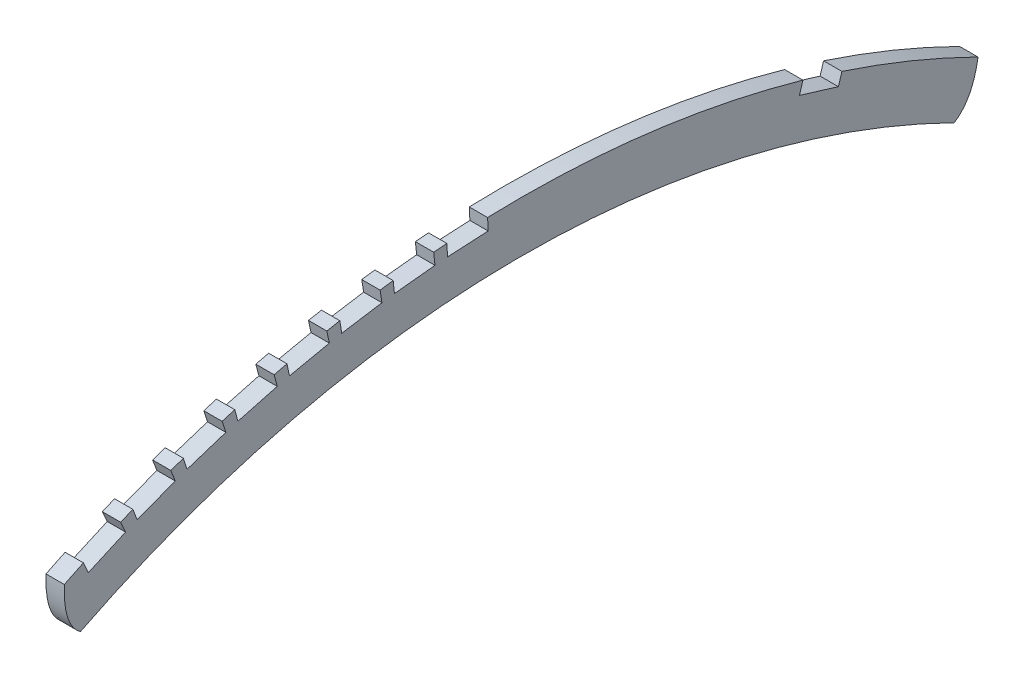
SolidWorks part; units mm, degrees
ref_plane "Front Plane" through (0, 0, 0) normal (0, 0, 1) x (1, 0, 0)
ref_plane "Top Plane" through (0, 0, 0) normal (0, 1, 0) x (1, 0, 0)
ref_plane "Right Plane" through (0, 0, 0) normal (1, 0, 0) x (0, 0, -1)
sketch "Sketch1" plane through (0, 0, 0) normal (1, 0, 0) x (0, 0, -1)
  line L2 (314.9485, 961.744) -> (311.4978, 950.4573)
  line L3 (311.4978, 950.4573) -> (292.3717, 956.3048)
  line L4 (292.3717, 956.3048) -> (273.2456, 962.1522)
  line L5 (273.2456, 962.1522) -> (276.6963, 973.4388)
  line L673 (-406.7366, 913.5455) -> (-425.0076, 905.4107)
  line L674 (-425.0076, 905.4107) -> (-429.808, 916.1927)
  line L677 (-393.2662, 932.4622) -> (-388.4657, 921.6802)
  line L678 (-388.4657, 921.6802) -> (-406.7366, 913.5455)
  line L679 (-358.3679, 933.5804) -> (-377.0396, 926.4131)
  line L680 (-377.0396, 926.4131) -> (-381.2691, 937.4315)
  line L683 (-343.9259, 951.7662) -> (-339.6963, 940.7478)
  line L684 (-339.6963, 940.7478) -> (-358.3679, 933.5804)
  line L685 (-309.017, 951.0565) -> (-328.0381, 944.8762)
  line L686 (-328.0381, 944.8762) -> (-331.6852, 956.1009)
  line L689 (-293.643, 968.4616) -> (-289.9959, 957.2369)
  line L690 (-289.9959, 957.2369) -> (-309.017, 951.0565)
  line L691 (-258.819, 965.9258) -> (-278.1376, 960.7494)
  line L692 (-278.1376, 960.7494) -> (-281.1922, 972.1496)
  line L695 (-242.5552, 982.5024) -> (-239.5005, 971.1022)
  line L696 (-239.5005, 971.1022) -> (-258.819, 965.9258)
  line L697 (-207.9117, 978.1476) -> (-227.4746, 973.9894)
  line L698 (-227.4746, 973.9894) -> (-229.9285, 985.5338)
  line L701 (-190.8026, 993.8503) -> (-188.3487, 982.3058)
  line L702 (-188.3487, 982.3058) -> (-207.9117, 978.1476)
  line L703 (-156.4345, 987.6883) -> (-176.1882, 984.5597)
  line L704 (-176.1882, 984.5597) -> (-178.0345, 996.2167)
  line L707 (-138.527, 1002.4741) -> (-136.6807, 990.817)
  line L708 (-136.6807, 990.817) -> (-156.4345, 987.6883)
  line L709 (-104.5285, 994.5219) -> (-124.4189, 992.4313)
  line L710 (-124.4189, 992.4313) -> (-125.6526, 1004.169)
  line L713 (-85.8717, 1008.3502) -> (-84.638, 996.6125)
  line L714 (-84.638, 996.6125) -> (-104.5285, 994.5219)
  line L715 (-52.336, 998.6295) -> (-72.3085, 997.5828)
  line L716 (-72.3085, 997.5828) -> (-72.9262, 1009.369)
  line L719 (-32.9811, 1011.4624) -> (-32.3634, 999.6763)
  line L720 (-32.3634, 999.6763) -> (-52.336, 998.6295)
  arc A0 (448.5735, 907.1526) -> (314.9485, 961.744) centre (0, 0) ccw
  arc A1 (276.6963, 973.4388) -> (-32.9811, 1011.4624) centre (0, 0) ccw
  arc A3 (-229.9285, 985.5338) -> (-242.5552, 982.5024) centre (0, 0) ccw
  arc A4 (-178.0345, 996.2167) -> (-190.8026, 993.8503) centre (0, 0) ccw
  arc A5 (-125.6526, 1004.169) -> (-138.527, 1002.4741) centre (0, 0) ccw
  arc A6 (-72.9262, 1009.369) -> (-85.8717, 1008.3502) centre (0, 0) ccw
  arc A7 (-281.1922, 972.1496) -> (-293.643, 968.4616) centre (0, 0) ccw
  arc A8 (-381.2691, 937.4315) -> (-393.2662, 932.4622) centre (0, 0) ccw
  arc A9 (-429.808, 916.1927) -> (-448.5735, 907.1526) centre (0, 0) ccw
  arc A10 (-331.6852, 956.1009) -> (-343.9259, 951.7662) centre (0, 0) ccw
  arc A11 (425.2382, 862.9116) -> (-432.7086, 859.1899) centre (0, 0) ccw
  spline S0 degree 3 poles (-448.5735, 907.1526) (-449.446, 883.2768) (-444.1577, 867.2893) (-432.7086, 859.1899) knots 0 0 0 0 0.457409 0.457409 0.457409 0.457409
  spline S1 degree 3 poles (425.2382, 862.9116) (437.4043, 870.6994) (445.1827, 885.4463) (448.5735, 907.1526) knots 0.531871 0.531871 0.531871 0.531871 1 1 1 1
  point P6 (-52.336, 998.6295)
  point P10 (292.3717, 956.3048)
  point P32 (0, 0)
  dimension "D1" = 2
extrude "Boss-Extrude1" add sketch "Sketch1" along normal blind 18
